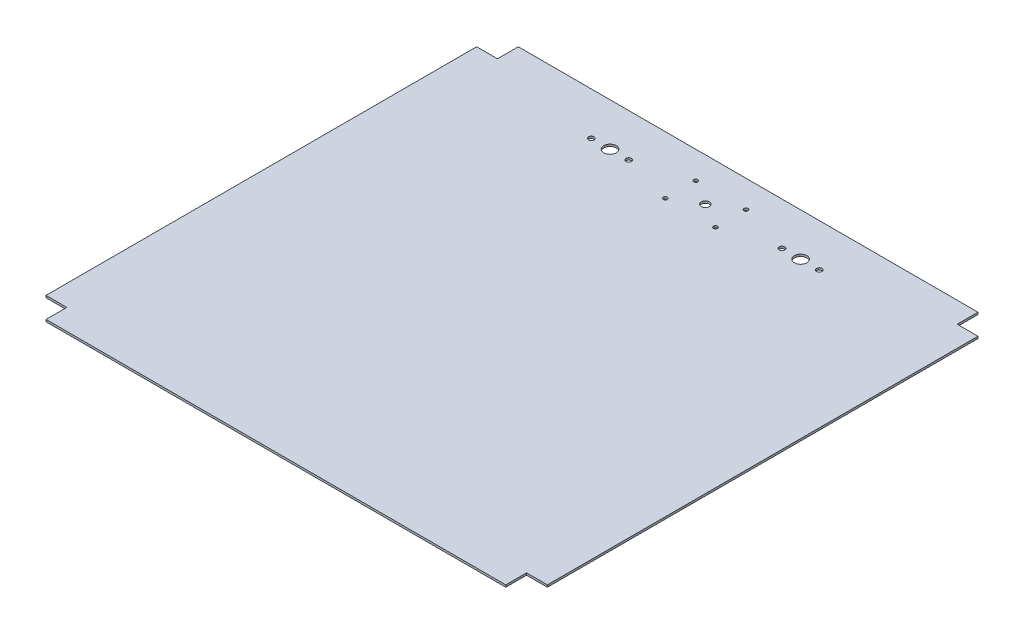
SolidWorks part; units mm, degrees
other "Markup1"
sketch "Sketch5" plane through (-221, 2, -207) normal (0, 1, 0) x (1, 0, 0)
other "Markup2"
sketch "Sketch6" plane through (-221, 2, -207) normal (0, 1, 0) x (1, 0, 0)
ref_plane "Front Plane" through (0, 0, 0) normal (0, 0, 1) x (1, 0, 0)
ref_plane "Top Plane" through (0, 0, 0) normal (0, 1, 0) x (1, 0, 0)
ref_plane "Right Plane" through (0, 0, 0) normal (1, 0, 0) x (0, 0, -1)
sketch "Sketch1" plane through (0, 0, 0) normal (0, 1, 0) x (1, 0, 0)
  line L1 (-241, 227) -> (241, 227)
  line L2 (-241, 227) -> (-241, -227)
  line L3 (-241, -227) -> (241, -227)
  line L4 (241, 227) -> (241, -227)
  line L5 (-241, 227) -> (241, -227) construction
  line L6 (-241, -227) -> (241, 227) construction
  point P0 (0, 0)
  dimension "D1" = 482
  dimension "D2" = 454
extrude "Boss-Extrude1" add sketch "Sketch1" along normal blind 2
sketch "Sketch3" plane through (0, 2, 0) normal (0, 1, 0) x (1, 0, 0)
  line L0 (0, 227.2798) -> (0, -288.7741) construction
  line L1 (-241, 227) -> (-221, 227)
  line L2 (-241, 227) -> (-241, 207)
  line L3 (-241, 207) -> (-221, 207)
  line L4 (-221, 227) -> (-221, 207)
  line L5 (-283.3726, 0) -> (319.9368, 0) construction
  line L6 (241, 227) -> (241, 207)
  line L7 (241, 227) -> (221, 227)
  line L8 (221, 227) -> (221, 207)
  line L9 (241, 207) -> (221, 207)
  line L10 (241, -227) -> (241, -207)
  line L11 (241, -207) -> (221, -207)
  line L12 (241, -227) -> (221, -227)
  line L13 (221, -227) -> (221, -207)
  line L14 (-241, -227) -> (-241, -207)
  line L15 (-221, -227) -> (-221, -207)
  line L16 (-241, -227) -> (-221, -227)
  line L17 (-241, -207) -> (-221, -207)
  dimension "D1" = 20
  dimension "D2" = 20
extrude "Cut-Extrude3" cut sketch "Sketch3" against normal blind 2
sketch "Sketch4" plane through (0, 2, 0) normal (0, 1, 0) x (1, 0, 0)
  line L0 (0, 231.0873) -> (0, -224.4315) construction
  line L1 (-259.5833, 0) -> (283.2953, 0) construction
  line L3 (221, 227) -> (-221, 227) construction
  line L6 (241, -207) -> (241, 207) construction
  line L7 (-241, 207) -> (-241, -207) construction
  circle A11 centre (0, 185.85) radius 3.9
  circle A12 centre (-24.1, 200.85) radius 1.95
  circle A13 centre (-24.1, 171.55) radius 1.95
  circle A14 centre (24.1, 200.85) radius 1.95
  circle A15 centre (24.1, 171.55) radius 1.95
  circle A16 centre (-91.6, 185.85) radius 6
  circle A17 centre (-73.65, 185.85) radius 2.65
  circle A18 centre (-109.55, 185.85) radius 2.65
  circle A19 centre (91.6, 185.85) radius 6
  circle A20 centre (109.55, 185.85) radius 2.65
  circle A21 centre (73.65, 185.85) radius 2.65
  point P20 (0, 0)
  dimension "D1" = 7.8
  dimension "D2" = 3.9
  dimension "D3" = 3.9
  dimension "D4" = 3.9
  dimension "D5" = 3.9
  dimension "D7" = 24.1
  dimension "D9" = 216.9
  dimension "D12" = 26.15
  dimension "D13" = 5.3
  dimension "D14" = 12
  dimension "D15" = 5.3
  dimension "D6" = 24.1
  dimension "D8" = 29.3
  dimension "D10" = 241
  dimension "D11" = 241
  dimension "D16" = 17.95
  dimension "D17" = 17.95
  dimension "D18" = 91.6
  dimension "D19" = 41.15
extrude "Cut-Extrude4" cut sketch "Sketch4" against normal blind 2
